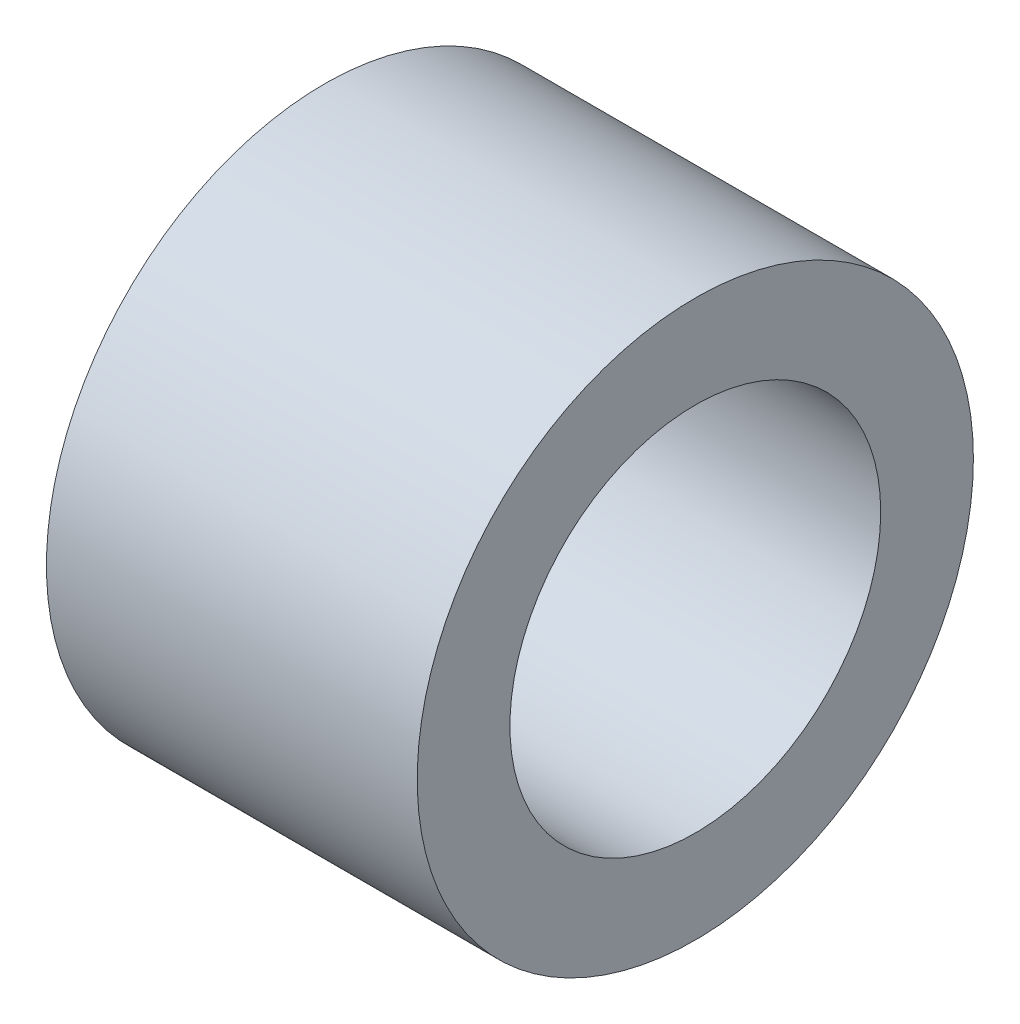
SolidWorks part; units mm, degrees
ref_plane "Front Plane" through (0, 0, 0) normal (1, 0, 0) x (0, 1, 0)
ref_plane "Top Plane" through (0, 0, 0) normal (0, 0, 1) x (0, 1, 0)
ref_plane "Right Plane" through (0, 0, 0) normal (0, 1, 0) x (-1, 0, 0)
sketch "Sketch1" plane through (0, 0, 0) normal (1, 0, 0) x (0, 1, 0)
  circle A0 centre (0, 0) radius 3.175
  circle A1 centre (0, 0) radius 4.7625
  dimension "D1" = 6.35
  dimension "D2" = 9.525
extrude "Boss-Extrude1" add sketch "Sketch1" along normal blind 6.35
